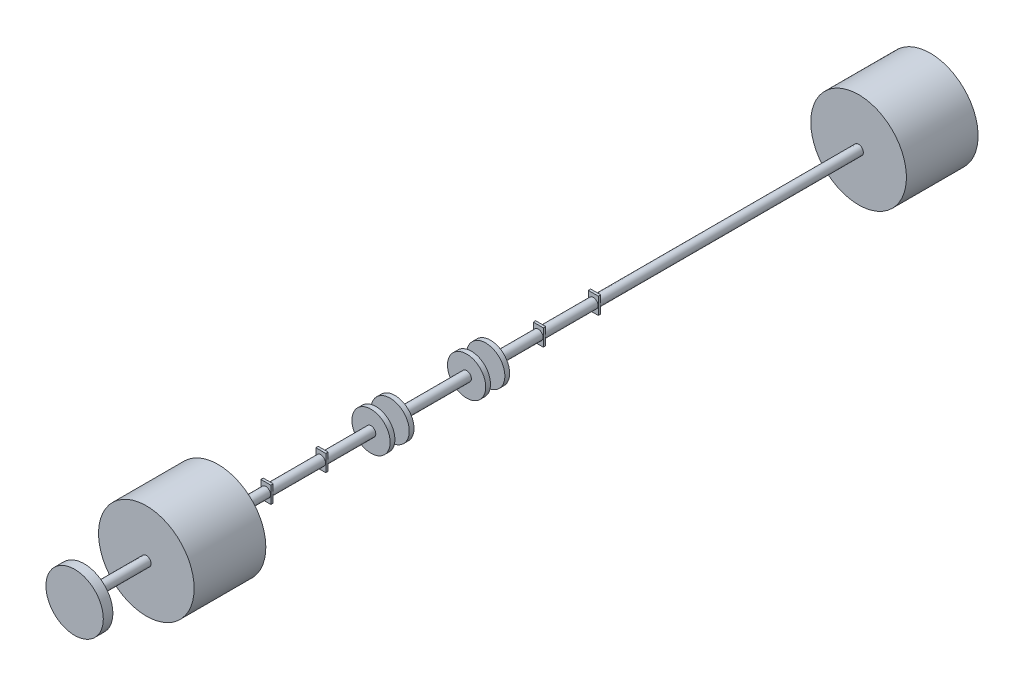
SolidWorks part; units mm, degrees
ref_plane "Plan de face" through (0, 0, 0) normal (0, 0, 1) x (1, 0, 0)
ref_plane "Plan de dessus" through (0, 0, 0) normal (0, 1, 0) x (1, 0, 0)
ref_plane "Plan de droite" through (0, 0, 0) normal (1, 0, 0) x (0, 0, -1)
sketch "Esquisse1" plane through (0, 0, 0) normal (0, 0, 1) x (1, 0, 0)
  circle A0 centre (0, 0) radius 10
  dimension "D1" = 20
extrude "Extrusion1" add sketch "Esquisse1" along normal blind 100
sketch "Esquisse2" plane through (0, 0, 0) normal (0, 0, -1) x (-1, 0, 0)
  line L1 (-10.5, 17.5) -> (10.5, 17.5)
  line L2 (-10.5, 17.5) -> (-10.5, -17.5)
  line L3 (-10.5, -17.5) -> (10.5, -17.5)
  line L4 (10.5, 17.5) -> (10.5, -17.5)
  dimension "D1" = 21
  dimension "D2" = 10.5
  dimension "D3" = 35
  dimension "D4" = 17.5
extrude "Extrusion2" add sketch "Esquisse2" along normal blind 5
sketch "Esquisse3" plane through (0, 0, -5) normal (0, 0, -1) x (-1, 0, 0)
  circle A0 centre (0, 0) radius 10 construction
  circle A1 centre (0, 0) radius 10
extrude "Extrusion3" add sketch "Esquisse3" along normal blind 110
sketch "Esquisse4" plane through (0, 0, -115) normal (0, 0, -1) x (-1, 0, 0)
  line L4 (-10.5, 17.5) -> (-10.5, -17.5)
  line L5 (-10.5, -17.5) -> (10.5, -17.5)
  line L6 (10.5, -17.5) -> (10.5, 17.5)
  line L7 (10.5, 17.5) -> (-10.5, 17.5)
  line L8 (-10.5, 17.5) -> (-10.5, -17.5)
  line L9 (-10.5, -17.5) -> (10.5, -17.5)
  line L10 (10.5, -17.5) -> (10.5, 17.5)
  line L11 (10.5, 17.5) -> (-10.5, 17.5)
  dimension "D1" = 0
extrude "Extrusion4" add sketch "Esquisse4" along normal blind 5
sketch "Esquisse5" plane through (0, 0, -120) normal (0, 0, -1) x (-1, 0, 0)
  circle A0 centre (0, 0) radius 10 construction
  circle A1 centre (0, 0) radius 10
extrude "Extrusion5" add sketch "Esquisse5" along normal blind 100
sketch "Esquisse12" plane through (0, 0, -220) normal (0, 0, -1) x (-1, 0, 0)
  circle A0 centre (0, 0) radius 40
  dimension "D1" = 80
extrude "Extrusion10" add sketch "Esquisse12" along normal blind 10
sketch "Esquisse13" plane through (0, 0, -230) normal (0, 0, -1) x (-1, 0, 0)
  circle A0 centre (0, 0) radius 10 construction
  circle A1 centre (0, 0) radius 10
extrude "Extrusion11" add sketch "Esquisse13" along normal blind 30
sketch "Esquisse14" plane through (0, 0, -260) normal (0, 0, -1) x (-1, 0, 0)
  circle A0 centre (0, 0) radius 40 construction
  circle A1 centre (0, 0) radius 40
extrude "Extrusion12" add sketch "Esquisse14" along normal blind 10
sketch "Esquisse15" plane through (0, 0, -270) normal (0, 0, -1) x (-1, 0, 0)
  circle A0 centre (0, 0) radius 10 construction
  circle A1 centre (0, 0) radius 10
extrude "Extrusion13" add sketch "Esquisse15" along normal blind 150
sketch "Esquisse16" plane through (0, 0, -420) normal (0, 0, -1) x (-1, 0, 0)
  circle A0 centre (0, 0) radius 40 construction
  circle A1 centre (0, 0) radius 40
extrude "Extrusion14" add sketch "Esquisse16" along normal blind 10
sketch "Esquisse17" plane through (0, 0, -430) normal (0, 0, -1) x (-1, 0, 0)
  circle A0 centre (0, 0) radius 10 construction
  circle A1 centre (0, 0) radius 10
extrude "Extrusion15" add sketch "Esquisse17" along normal blind 30
sketch "Esquisse18" plane through (0, 0, -460) normal (0, 0, -1) x (-1, 0, 0)
  circle A0 centre (0, 0) radius 40 construction
  circle A1 centre (0, 0) radius 40
extrude "Extrusion16" add sketch "Esquisse18" along normal blind 10
sketch "Esquisse19" plane through (0, 0, -470) normal (0, 0, -1) x (-1, 0, 0)
  circle A0 centre (0, 0) radius 10 construction
  circle A1 centre (0, 0) radius 10
extrude "Extrusion17" add sketch "Esquisse19" along normal blind 100
sketch "Esquisse20" plane through (0, 0, -570) normal (0, 0, -1) x (-1, 0, 0)
  line L4 (10.5, 17.5) -> (-10.5, 17.5)
  line L5 (-10.5, 17.5) -> (-10.5, -17.5)
  line L6 (-10.5, -17.5) -> (10.5, -17.5)
  line L7 (10.5, -17.5) -> (10.5, 17.5)
  line L8 (10.5, 17.5) -> (-10.5, 17.5)
  line L9 (-10.5, 17.5) -> (-10.5, -17.5)
  line L10 (-10.5, -17.5) -> (10.5, -17.5)
  line L11 (10.5, -17.5) -> (10.5, 17.5)
  dimension "D1" = 0
extrude "Extrusion18" add sketch "Esquisse20" along normal blind 5
sketch "Esquisse21" plane through (0, 0, -575) normal (0, 0, -1) x (-1, 0, 0)
  circle A0 centre (0, 0) radius 10 construction
  circle A1 centre (0, 0) radius 10
extrude "Extrusion19" add sketch "Esquisse21" along normal blind 110
sketch "Esquisse22" plane through (0, 0, -685) normal (0, 0, -1) x (-1, 0, 0)
  line L4 (10.5, -17.5) -> (10.5, 17.5)
  line L5 (10.5, 17.5) -> (-10.5, 17.5)
  line L6 (-10.5, 17.5) -> (-10.5, -17.5)
  line L7 (-10.5, -17.5) -> (10.5, -17.5)
  line L8 (10.5, -17.5) -> (10.5, 17.5)
  line L9 (10.5, 17.5) -> (-10.5, 17.5)
  line L10 (-10.5, 17.5) -> (-10.5, -17.5)
  line L11 (-10.5, -17.5) -> (10.5, -17.5)
  dimension "D1" = 0
extrude "Extrusion20" add sketch "Esquisse22" along normal blind 5
sketch "Esquisse23" plane through (0, 0, -690) normal (0, 0, -1) x (-1, 0, 0)
  circle A0 centre (0, 0) radius 10 construction
  circle A1 centre (0, 0) radius 10
extrude "Extrusion21" add sketch "Esquisse23" along normal blind 550
sketch "Esquisse25" plane through (0, 0, 0) normal (0, 1, 0) x (1, 0, 0)
  line L0 (40, 430) -> (-40, 430) construction
  line L1 (-40, 460) -> (40, 460)
  line L2 (-40, 460) -> (-40, 430)
  line L3 (-40, 430) -> (40, 430)
  line L4 (40, 460) -> (40, 430)
  line L5 (40, 230) -> (-40, 230) construction
  line L6 (-40, 260) -> (40, 260)
  line L7 (-40, 260) -> (-40, 230)
  line L8 (-40, 230) -> (40, 230)
  line L9 (40, 260) -> (40, 230)
extrude "Enlèv. mat.-Extru.1" cut sketch "Esquisse25" against normal through all and the other way through all
sketch "Esquisse26" plane through (0, 0, 100) normal (0, 0, 1) x (1, 0, 0)
  circle A0 centre (0, 0) radius 100
  dimension "D1" = 200
extrude "Extrusion22" add sketch "Esquisse26" along normal blind 150
sketch "Esquisse27" plane through (0, 0, -1240) normal (0, 0, -1) x (-1, 0, 0)
  circle A0 centre (0, 0) radius 100
  dimension "D1" = 200
extrude "Extrusion23" add sketch "Esquisse27" along normal blind 150
sketch "Esquisse28" plane through (0, 0, 250) normal (0, 0, 1) x (1, 0, 0)
  circle A0 centre (0, 0) radius 10
  dimension "D1" = 20
extrude "Extrusion24" add sketch "Esquisse28" along normal blind 130
sketch "Esquisse29" plane through (0, 0, 380) normal (0, 0, 1) x (1, 0, 0)
  circle A0 centre (0, 0) radius 60
  dimension "D1" = 120
extrude "Extrusion25" add sketch "Esquisse29" along normal blind 20
